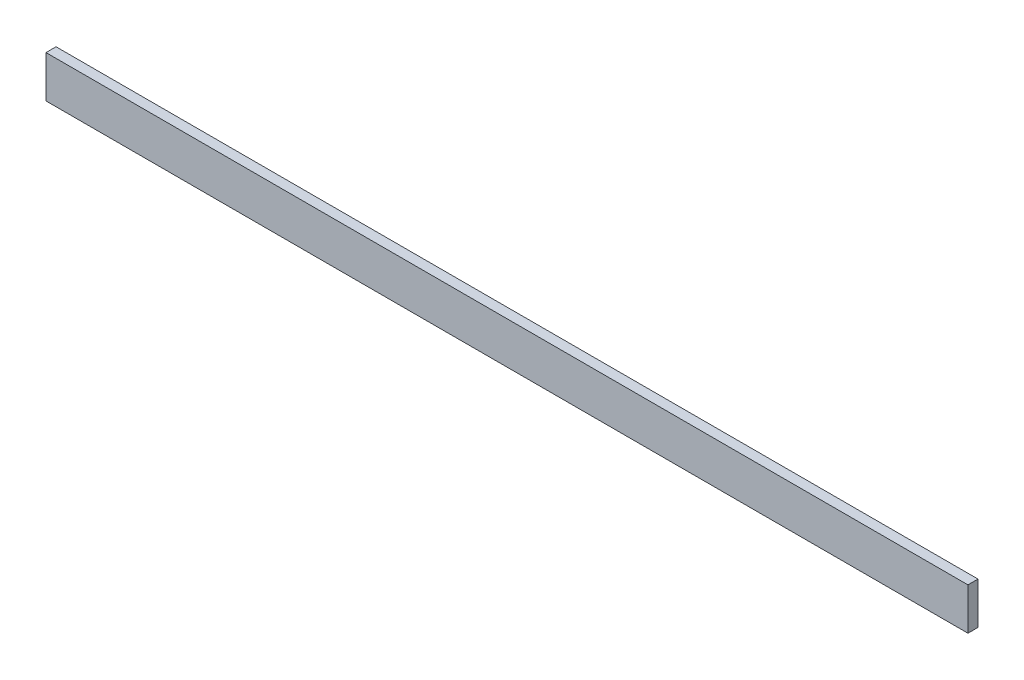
SolidWorks part; units mm, degrees
ref_plane "Front Plane" through (0, 0, 0) normal (0, 0, 1) x (1, 0, 0)
ref_plane "Top Plane" through (0, 0, 0) normal (0, 1, 0) x (1, 0, 0)
ref_plane "Right Plane" through (0, 0, 0) normal (1, 0, 0) x (0, 0, -1)
sketch "Sketch1" plane through (0, 0, 0) normal (0, 0, 1) x (1, 0, 0)
  line L1 (-550, 25) -> (550, 25)
  line L2 (-550, 25) -> (-550, -25)
  line L3 (-550, -25) -> (550, -25)
  line L4 (550, 25) -> (550, -25)
  line L5 (-550, 25) -> (550, -25) construction
  line L6 (-550, -25) -> (550, 25) construction
  point P0 (0, 0)
  dimension "D1" = 1100
  dimension "D2" = 50
extrude "Boss-Extrude1" add sketch "Sketch1" along normal blind 12
